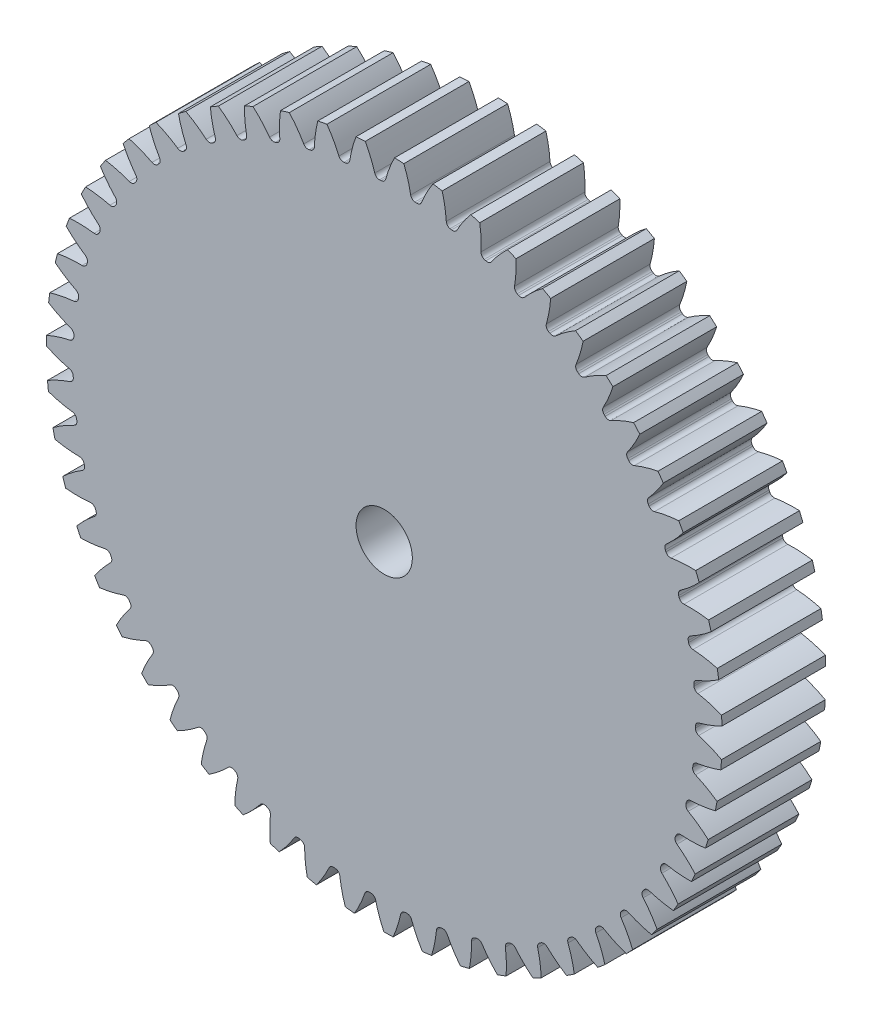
SolidWorks part; units mm, degrees
ref_plane "Front" through (0, 0, 0) normal (0, 0, 1) x (1, 0, 0)
ref_plane "Top" through (0, 0, 0) normal (0, 1, 0) x (1, 0, 0)
ref_plane "Right" through (0, 0, 0) normal (1, 0, 0) x (0, 0, -1)
sketch "Sketch3" plane through (0, 0, 0) normal (0, 0, 1) x (1, 0, 0)
  circle A0 centre (0, 0) radius 289.56
  dimension "od" = 579.12
extrude "gearBody" add sketch "Sketch3" along normal blind 88.9
sketch "Sketch2" plane through (0, 0, 0) normal (0, 0, 1) x (1, 0, 0)
  line L0 (0, 0) -> (242.5647, 100.4736) construction
  line L1 (289.159, -17.2123) -> (0, 0) construction
  line L2 (0, 0) -> (36.3143, 0) construction
  line L3 (279.378, 3.5077) -> (279.1253, -12.386) construction
  line L5 (279.2517, -4.4392) -> (0, 0) construction
  line L7 (0, 0) -> (262.5501, 0) construction
  arc A0 (262.5469, -1.3022) -> (262.4556, -7.0436) centre (0, 0) ccw construction
  arc A1 (289.4506, 7.9571) -> (289.0515, -17.1533) centre (0, 0) ccw construction
  arc A2 (279.378, 3.5077) -> (279.1253, -12.386) centre (0, 0) ccw construction
  arc A3 (266.6547, -4.9175) -> (266.6762, -3.5607) centre (0, 0) ccw
  arc A4 (289.159, -17.2123) -> (269.5798, -8.9481) centre (239.2485, -108.1328) ccw
  arc A5 (289.159, -17.2123) -> (289.56, 8.0126) centre (0, 0) ccw
  arc A6 (289.56, 8.0126) -> (269.728, 0.3749) centre (242.5647, 100.4736) cw
  arc A7 (266.6762, -3.5607) -> (269.728, 0.3749) centre (270.811, -3.6159) cw
  arc A8 (269.5798, -8.9481) -> (266.6547, -4.9175) centre (270.7891, -4.9937) cw
  point P6 (289.56, 8.0126)
  point P22 (289.159, -17.2123)
  dimension "baseDia" = 525.1002
  dimension "od" = 579.12
  dimension "pd" = 558.8
  dimension "rd" = 533.4
  dimension "rFillet" = 4.1351
  dimension "pointX" = 289.56
  dimension "pointY" = 8.0126
  dimension "CTT" = 15.8937
  dimension "flankCenterAngle" = 22.5
extrude "toothCut" cut sketch "Sketch2" along normal through all
pattern_circular "CirPattern1" count 55 over 360 about axis through (0, 0, 0) along (0, 0, 1) of "toothCut"
sketch "hub1Dia" plane through (0, 0, 0) normal (0, 0, -1) x (-1, 0, 0)
  circle A0 centre (0, 0) radius 12.7
  dimension "hub1Dia" = 25.4
sketch "hub2Dia" plane through (0, 0, 88.9) normal (0, 0, 1) x (1, 0, 0)
  circle A0 centre (0, 0) radius 12.7
  dimension "hub2dia" = 25.4
sketch "boreDia" plane through (0, 0, 0) normal (0, 0, 1) x (1, 0, 0)
  circle A0 centre (0, 0) radius 24.13
  dimension "boreDia" = 48.26
extrude "bore" cut sketch "boreDia" against normal mid plane 25400
